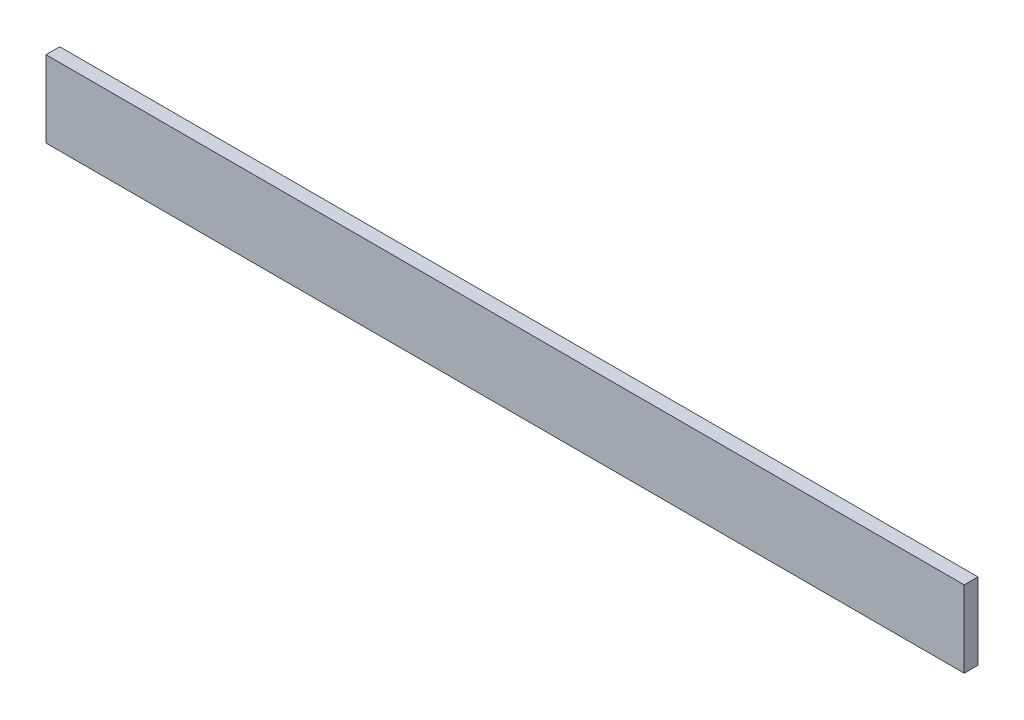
SolidWorks part; units mm, degrees
ref_plane "Front Plane" through (0, 0, 0) normal (0, 0, 1) x (1, 0, 0)
ref_plane "Top Plane" through (0, 0, 0) normal (0, 1, 0) x (1, 0, 0)
ref_plane "Right Plane" through (0, 0, 0) normal (1, 0, 0) x (0, 0, -1)
sketch "Sketch1" plane through (0, 0, 0) normal (0, 0, 1) x (1, 0, 0)
  line L1 (-600, 50) -> (600, 50)
  line L2 (-600, 50) -> (-600, -50)
  line L3 (-600, -50) -> (600, -50)
  line L4 (600, 50) -> (600, -50)
  line L5 (-600, 50) -> (600, -50) construction
  line L6 (-600, -50) -> (600, 50) construction
  point P0 (0, 0)
  dimension "D1" = 100
  dimension "D2" = 1200
extrude "Boss-Extrude1" add sketch "Sketch1" along normal blind 18
